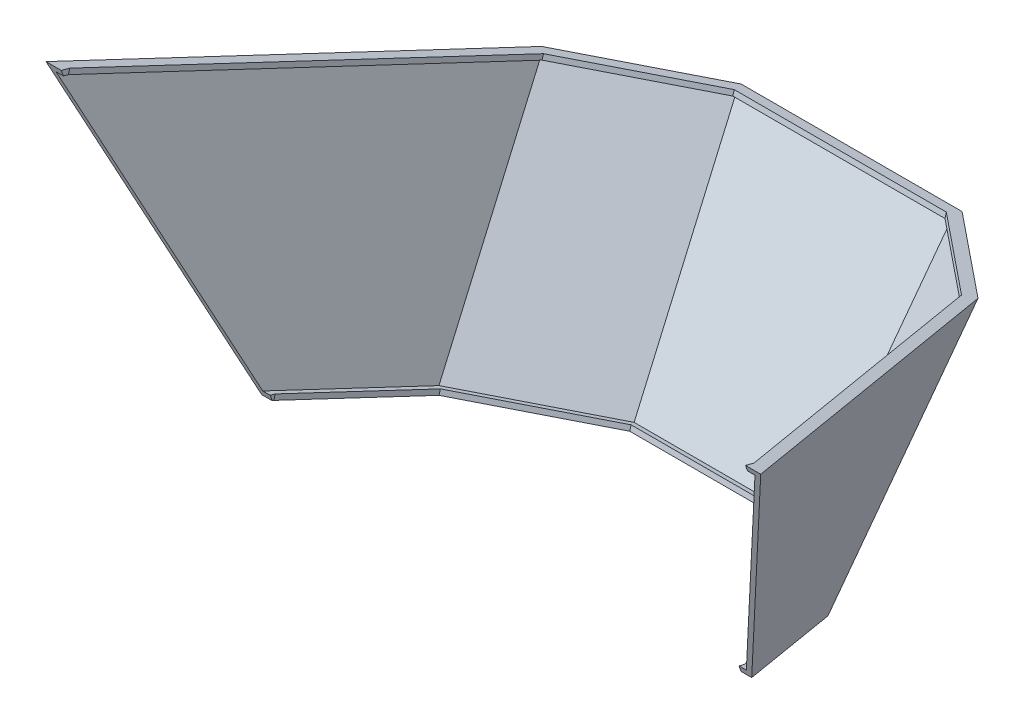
SolidWorks part; units mm, degrees
ref_plane "Plan de face" through (0, 0, 0) normal (0, 0, 1) x (1, 0, 0)
ref_plane "Plan de dessus" through (0, 0, 0) normal (0, 1, 0) x (1, 0, 0)
ref_plane "Plan de droite" through (0, 0, 0) normal (1, 0, 0) x (0, 0, -1)
sketch "Esquisse1" plane through (0, 0, 0) normal (1, 0, 0) x (0, 0, -1)
  line L0 (800, 150) -> (0, 150) construction
  line L1 (0, 0) -> (800, 0) construction
  line L2 (0, 0) -> (0, 600) construction
  line L3 (0, 600) -> (800, 600) construction
  line L4 (800, 0) -> (800, 600) construction
  line L8 (0, 46.1342) -> (0, 150) construction
  line L9 (0, 150) -> (634.5299, 150) construction
  line L13 (634.5299, 150) -> (750, 350)
  line L14 (750, 350) -> (392.963, 600)
  line L15 (392.963, 600) -> (316.2897, 600)
  line L16 (316.2897, 600) -> (58.9488, 480)
  line L17 (58.9488, 480) -> (0, 260)
  line L18 (0, 260) -> (110, 150)
  line L19 (750, 350) -> (800, 436.6025) construction
  line L20 (750, 350) -> (800, 350) construction
  line L21 (750, 350) -> (392.963, 350) construction
  line L22 (392.963, 350) -> (392.963, 600) construction
  line L23 (316.2897, 600) -> (316.2897, 480) construction
  line L24 (58.9488, 480) -> (316.2897, 480) construction
  line L25 (0, 260) -> (58.9488, 260) construction
  line L26 (58.9488, 480) -> (58.9488, 260) construction
  line L27 (110, 150) -> (634.5299, 150)
  line L28 (750, 350) -> (750, 600) construction
  line L29 (110, 150) -> (110, 260) construction
  line L30 (110, 260) -> (58.9488, 260) construction
  dimension "D1" = 800
  dimension "D2" = 600
  dimension "D3" = 150
  dimension "D4" = 60
  dimension "D5" = 200
  dimension "D6" = 35
  dimension "D7" = 50
  dimension "D8" = 15
  dimension "D9" = 25
  dimension "D10" = 45
  dimension "D11" = 110
  dimension "D12" = 330
extrude "Boss.-Extru.1" add sketch "Esquisse1" along normal blind 450
chamfer "Chanfrein1" distance 90 angle 70 2 edges at (450, 250, -692.265) (0, 250, -692.265)
chamfer "Chanfrein5" distance 35 angle 75 2 edges at (405, 150, -491.7668) (45, 150, -491.7668)
chamfer "Chanfrein6" distance 65 angle 70 2 edges at (450, 150, -171.2901) (0, 150, -171.2901)
chamfer "Chanfrein2" distance 45 angle 60 8 edges at (0, 404.293, -38.6632) (0, 540, -187.6192) (0, 600, -354.6263) (450, 404.293, -38.6632) (450, 540, -187.6192) (450, 600, -354.6263) (405.0184, 205, -55) (44.9816, 205, -55)
chamfer "Chanfrein7" distance 45 angle 40 2 edges at (333.1984, 250, -692.265) (116.8016, 250, -692.265)
chamfer "Chanfrein3" distance 30 angle 30 5 edges at (225, 350, -750) (408.6929, 439.7246, -621.8599) (41.3071, 439.7246, -621.8599) (332.6576, 366.6126, -726.2747) (117.3424, 366.6126, -726.2747)
chamfer "Chanfrein8" distance 30 angle 30 2 edges at (0, 512.1288, -503.7439) (450, 512.1288, -503.7439)
sketch "Esquisse4" plane through (0, 0, 0) normal (0, 1, 0) x (1, 0, 0)
  line L0 (450, 426.8081) -> (450, 326.2659) construction
  line L1 (0, 426.8081) -> (450, 426.8081)
  line L2 (0, 426.8081) -> (0, -58.529)
  line L3 (0, -58.529) -> (450, -58.529)
  line L4 (450, 426.8081) -> (450, -58.529)
extrude "Enlèv. mat.-Extru.2" cut sketch "Esquisse4" along normal through all
sketch "Esquisse6" plane through (0, 587.2383, -411.1887) normal (0, 0.8192, -0.5736) x (1, 0, 0)
  line L1 (-151.0015, 506.7596) -> (591.2398, 506.7596)
  line L2 (-151.0015, 506.7596) -> (-151.0015, -137.8948)
  line L3 (-151.0015, -137.8948) -> (591.2398, -137.8948)
  line L4 (591.2398, 506.7596) -> (591.2398, -137.8948)
extrude "Enlèv. mat.-Extru.4" cut sketch "Esquisse6" against normal blind 50
sketch "Esquisse2" plane through (0, 0, 0) normal (1, 0, 0) x (0, 0, -1)
  line L0 (719.442, 297.0719) -> (464.442, 365.399) construction
  line L1 (724.9045, 306.5333) -> (634.5299, 150) construction
  line L2 (464.442, 365.399) -> (516.6332, 222.0049) construction
  line L3 (516.6332, 222.0049) -> (654.7372, 185) construction
  line L4 (654.7372, 185) -> (719.442, 297.0719) construction
  line L5 (516.6332, 222.0049) -> (548.9855, 342.7456) construction
  line L6 (464.442, 365.399) -> (516.6332, 222.0049) construction
  line L7 (479.0555, 325.2486) -> (701.3246, 265.6918) construction
  line L8 (719.442, 297.0719) -> (654.7372, 185) construction
  line L9 (509.0167, 213.6929) -> (659.5608, 173.3548)
  line L10 (506.1949, 250.6837) -> (667.6782, 207.4144) construction
  line L11 (734.6183, 303.3582) -> (659.5608, 173.3548)
  line L12 (734.6183, 303.3582) -> (448.4749, 380.0301)
  line L13 (497.8443, 273.6267) -> (678.0309, 225.3459) construction
  line L14 (448.4749, 380.0301) -> (509.0167, 213.6929)
  line L15 (690.9719, 247.7603) -> (487.4061, 302.3056) construction
  line L16 (654.7372, 185) -> (516.6332, 185) construction
  line L17 (516.6332, 222.0049) -> (516.6332, 185) construction
  line L19 (464.442, 365.399) -> (464.442, 150) construction
  line L21 (567.8967, 150) -> (438.7936, 150) construction
  line L26 (1088.4689, -11.1141) -> (143.9461, -11.1141)
  line L27 (1088.4689, -11.1141) -> (1088.4689, 603.7484)
  line L28 (1088.4689, 603.7484) -> (143.9461, 603.7484)
  line L29 (143.9461, -11.1141) -> (143.9461, 603.7484)
  dimension "D1" = 35
  dimension "D2" = 25
  dimension "D3" = 25
  dimension "D4" = 20
  dimension "D5" = 20
  dimension "D6" = 35
  dimension "D7" = 15
  dimension "D8" = 35
  dimension "D9" = 255
  dimension "D10" = 10
extrude "Enlèv. mat.-Extru.6" cut sketch "Esquisse2" along normal through all
sketch "Esquisse10" plane through (408.3637, -114.7278, -128.7193) normal (0.9212, -0.2588, -0.2904) x (-0.2796, 0.0785, -0.9569)
  line L8 (389.6066, 300.8446) -> (488.3267, 266.4987)
  line L9 (488.3267, 266.4987) -> (577.4164, 412.606)
  line L10 (577.4164, 412.606) -> (317.7465, 502.9483)
  line L11 (317.7465, 502.9483) -> (389.6066, 300.8446)
  line L12 (389.6066, 300.8446) -> (488.3267, 266.4987)
  line L13 (488.3267, 266.4987) -> (577.4164, 412.606)
  line L14 (577.4164, 412.606) -> (317.7465, 502.9483)
  line L15 (317.7465, 502.9483) -> (389.6066, 300.8446)
  dimension "D1" = 10
extrude "Enlèv. mat.-Extru.7" cut sketch "Esquisse10" against normal blind 10
sketch "Esquisse11" plane through (-26.453, -7.4319, -8.3382) normal (-0.9212, -0.2588, -0.2904) x (-0.2796, -0.0785, 0.9569)
  line L8 (-614.1286, 144.7855) -> (-515.4085, 179.1314)
  line L9 (-515.4085, 179.1314) -> (-443.5483, 381.2352)
  line L10 (-443.5483, 381.2352) -> (-703.2182, 290.8929)
  line L11 (-703.2182, 290.8929) -> (-614.1286, 144.7855)
  line L12 (-614.1286, 144.7855) -> (-515.4085, 179.1314)
  line L13 (-515.4085, 179.1314) -> (-443.5483, 381.2352)
  line L14 (-443.5483, 381.2352) -> (-703.2182, 290.8929)
  line L15 (-703.2182, 290.8929) -> (-614.1286, 144.7855)
  dimension "D1" = 10
extrude "Enlèv. mat.-Extru.8" cut sketch "Esquisse11" against normal blind 10
sketch "Esquisse12" plane through (-146.5912, -98.5505, -145.5681) normal (-0.6404, -0.4306, -0.636) x (-0.5278, -0.3548, 0.7717)
  line L8 (-572.8842, 93.8383) -> (-683.13, 224.2671)
  line L9 (-683.13, 224.2671) -> (-765.1654, 168.7524)
  line L10 (-765.1654, 168.7524) -> (-654.9197, 38.3236)
  line L11 (-654.9197, 38.3236) -> (-572.8842, 93.8383)
  line L12 (-572.8842, 93.8383) -> (-683.13, 224.2671)
  line L13 (-683.13, 224.2671) -> (-765.1654, 168.7524)
  line L14 (-765.1654, 168.7524) -> (-654.9197, 38.3236)
  line L15 (-654.9197, 38.3236) -> (-572.8842, 93.8383)
  dimension "D1" = 10
extrude "Enlèv. mat.-Extru.9" cut sketch "Esquisse12" against normal blind 10
sketch "Esquisse13" plane through (331.1647, -222.6358, -328.8535) normal (0.6404, -0.4306, -0.636) x (-0.5278, 0.3548, -0.7717)
  line L8 (445.6254, 475.3319) -> (335.3797, 344.9031)
  line L9 (335.3797, 344.9031) -> (417.4152, 289.3884)
  line L10 (417.4152, 289.3884) -> (527.6609, 419.8172)
  line L11 (527.6609, 419.8172) -> (445.6254, 475.3319)
  line L12 (445.6254, 475.3319) -> (335.3797, 344.9031)
  line L13 (335.3797, 344.9031) -> (417.4152, 289.3884)
  line L14 (417.4152, 289.3884) -> (527.6609, 419.8172)
  line L15 (527.6609, 419.8172) -> (445.6254, 475.3319)
  dimension "D1" = 10
extrude "Enlèv. mat.-Extru.10" cut sketch "Esquisse13" against normal blind 10
sketch "Esquisse14" plane through (0, -237.2595, -410.9456) normal (0, -0.5, -0.866) x (-1, 0, 0)
  line L8 (-158.6293, 637.3456) -> (-291.3707, 637.3456)
  line L9 (-291.3707, 637.3456) -> (-276.7915, 467.2305)
  line L10 (-276.7915, 467.2305) -> (-173.2085, 467.2305)
  line L11 (-173.2085, 467.2305) -> (-158.6293, 637.3456)
  line L12 (-158.6293, 637.3456) -> (-291.3707, 637.3456)
  line L13 (-291.3707, 637.3456) -> (-276.7915, 467.2305)
  line L14 (-276.7915, 467.2305) -> (-173.2085, 467.2305)
  line L15 (-173.2085, 467.2305) -> (-158.6293, 637.3456)
  dimension "D1" = 10
extrude "Enlèv. mat.-Extru.11" cut sketch "Esquisse14" against normal blind 10
shell "Coque1" thickness 3
sketch "Esquisse15" plane through (0, 329.5302, -88.2973) normal (0, 0.9659, -0.2588) x (1, 0, 0)
  line L6 (87.7095, 440.9262) -> (87.7095, 384.768)
  line L7 (87.7095, 384.768) -> (362.2905, 384.768)
  line L8 (362.2905, 384.768) -> (362.2905, 440.9262)
  line L12 (274.7981, 566.2118) -> (175.2019, 566.2118)
  line L13 (175.2019, 566.2118) -> (114.89, 512.9884)
  line L14 (114.89, 512.9884) -> (87.7095, 440.9262)
  line L15 (87.7095, 440.9262) -> (362.2905, 440.9262)
  line L16 (362.2905, 440.9262) -> (335.11, 512.9884)
  line L17 (335.11, 512.9884) -> (274.7981, 566.2118)
  line L18 (274.7981, 566.2118) -> (175.2019, 566.2118)
  line L19 (175.2019, 566.2118) -> (114.89, 512.9884)
  line L20 (114.89, 512.9884) -> (87.7095, 440.9262)
  line L21 (87.7095, 440.9262) -> (362.2905, 440.9262) construction
  line L22 (362.2905, 440.9262) -> (335.11, 512.9884)
  line L23 (335.11, 512.9884) -> (274.7981, 566.2118)
  dimension "D1" = 3
extrude "Enlèv. mat.-Extru.12" cut sketch "Esquisse15" against normal blind 10
sketch "Esquisse16" plane through (0, 463.7939, -124.2732) normal (0, -0.9659, 0.2588) x (-1, 0, 0)
  line L6 (-24.618, 343.5974) -> (-24.618, 175.2095)
  line L7 (-24.618, 175.2095) -> (-425.382, 175.2095)
  line L8 (-425.382, 175.2095) -> (-425.382, 343.5974)
  line L12 (-162.8691, 603.4568) -> (-287.1309, 603.4568)
  line L13 (-287.1309, 603.4568) -> (-347.4428, 550.2333)
  line L14 (-347.4428, 550.2333) -> (-425.382, 343.5974)
  line L15 (-425.382, 343.5974) -> (-24.618, 343.5974)
  line L16 (-24.618, 343.5974) -> (-102.5572, 550.2333)
  line L17 (-102.5572, 550.2333) -> (-162.8691, 603.4568)
  line L18 (-162.8691, 603.4568) -> (-287.1309, 603.4568)
  line L19 (-287.1309, 603.4568) -> (-347.4428, 550.2333)
  line L20 (-347.4428, 550.2333) -> (-425.382, 343.5974)
  line L21 (-425.382, 343.5974) -> (-24.618, 343.5974) construction
  line L22 (-24.618, 343.5974) -> (-102.5572, 550.2333)
  line L23 (-102.5572, 550.2333) -> (-162.8691, 603.4568)
  dimension "D1" = 3
extrude "Enlèv. mat.-Extru.13" cut sketch "Esquisse16" against normal blind 10
sketch "Esquisse18" plane through (0, 188.5921, -518.1526) normal (0, -0.342, 0.9397) x (1, 0, 0)
  line L12 (80.0955, 26.7117) -> (107.3445, -46.5759)
  line L13 (107.3445, -46.5759) -> (342.6555, -46.5759)
  line L14 (342.6555, -46.5759) -> (369.9045, 26.7117)
  line L24 (435.7193, 203.724) -> (425.382, 203.724)
  line L25 (425.382, 203.724) -> (425.382, 200.0617)
  line L26 (425.382, 200.0617) -> (24.618, 200.0617)
  line L27 (24.618, 200.0617) -> (24.618, 203.724)
  line L28 (24.618, 203.724) -> (14.2807, 203.724)
  line L29 (14.2807, 203.724) -> (80.0955, 26.7117)
  line L30 (80.0955, 26.7117) -> (87.7095, 26.7117)
  line L31 (87.7095, 26.7117) -> (87.7095, 30.374)
  line L32 (87.7095, 30.374) -> (362.2905, 30.374)
  line L33 (362.2905, 30.374) -> (362.2905, 26.7117)
  line L34 (362.2905, 26.7117) -> (369.9045, 26.7117)
  line L35 (369.9045, 26.7117) -> (435.7193, 203.724)
  line L36 (435.7193, 203.724) -> (425.382, 203.724)
  line L37 (425.382, 203.724) -> (425.382, 200.0617)
  line L38 (425.382, 200.0617) -> (24.618, 200.0617)
  line L39 (24.618, 200.0617) -> (24.618, 203.724)
  line L40 (24.618, 203.724) -> (14.2807, 203.724)
  line L41 (14.2807, 203.724) -> (80.0955, 26.7117)
  line L42 (80.0955, 26.7117) -> (87.7095, 26.7117) construction
  line L43 (87.7095, 26.7117) -> (87.7095, 30.374) construction
  line L44 (87.7095, 30.374) -> (362.2905, 30.374) construction
  line L45 (362.2905, 30.374) -> (362.2905, 26.7117) construction
  line L46 (362.2905, 26.7117) -> (369.9045, 26.7117) construction
  line L47 (369.9045, 26.7117) -> (435.7193, 203.724)
  dimension "D1" = 0
extrude "Enlèv. mat.-Extru.14" cut sketch "Esquisse18" against normal blind 3
